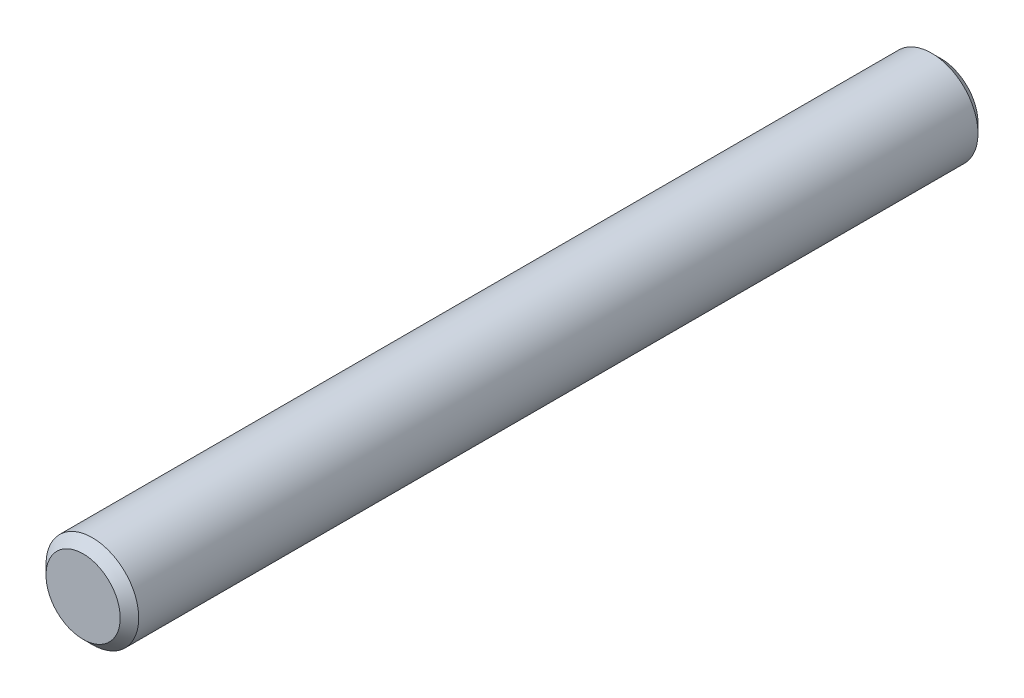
SolidWorks part; units mm, degrees
ref_plane "Face" through (0, 0, 0) normal (0, 0, 1) x (1, 0, 0)
ref_plane "Dessus" through (0, 0, 0) normal (0, 1, 0) x (1, 0, 0)
ref_plane "Droite" through (0, 0, 0) normal (1, 0, 0) x (0, 0, -1)
sketch "Esquisse1" plane through (0, 0, 0) normal (0, 0, 1) x (1, 0, 0)
  circle A0 centre (0, 0) radius 10
  dimension "D1" = 20
extrude "Extrusion1" add sketch "Esquisse1" along normal mid plane 185
chamfer "Chanfrein1" distance 2 angle 45 2 edges at (10, 0, -92.5) (10, 0, 92.5)
